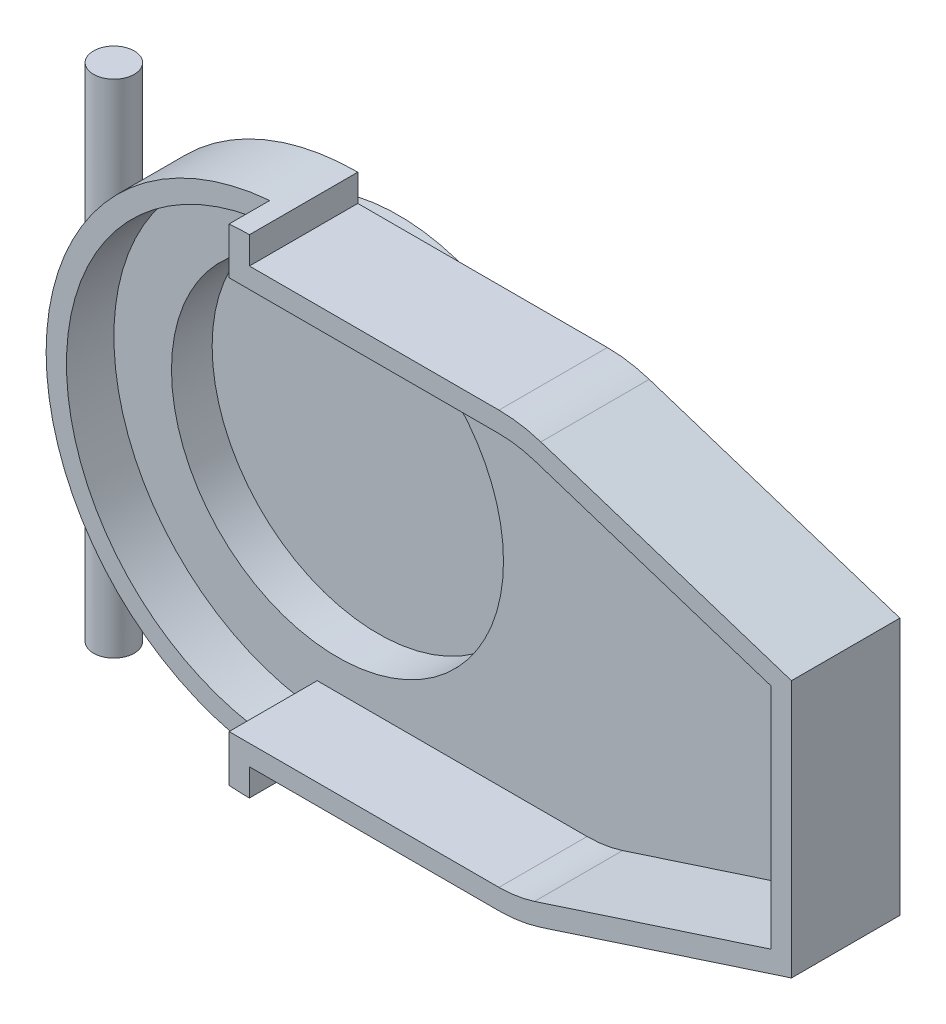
SolidWorks part; units mm, degrees
ref_plane "Plan de face" through (0, 0, 0) normal (0, 0, 1) x (1, 0, 0)
ref_plane "Plan de dessus" through (0, 0, 0) normal (0, 1, 0) x (1, 0, 0)
ref_plane "Plan de droite" through (0, 0, 0) normal (1, 0, 0) x (0, 0, -1)
sketch "Esquisse1" plane through (0, 0, 0) normal (0, 0, 1) x (1, 0, 0)
  circle A0 centre (0, 0) radius 13.75
  dimension "D1" = 27.5
extrude "Extrusion1" add sketch "Esquisse1" along normal blind 3
sketch "Esquisse3" plane through (137.6924, 0, 3) normal (0, 0, 1) x (1, 0, 0)
  line L0 (-79.3204, 0) -> (-194.2329, 0) construction
  line L1 (-137.6924, -16) -> (-119.2767, -16)
  line L2 (-116.1858, -15.5103) -> (-97.6924, -9.5)
  line L3 (-97.6924, -9.5) -> (-97.6924, 9.5)
  line L4 (-137.6924, -22.8025) -> (-137.6924, 21.1457) construction
  line L5 (-116.1858, 15.5103) -> (-97.6924, 9.5)
  line L6 (-137.6924, 16) -> (-119.2767, 16)
  line L7 (-137.6924, 16) -> (-137.6924, 18)
  line L8 (-137.6924, -16) -> (-137.6924, -18)
  arc A0 (-137.6924, 18) -> (-137.6924, -18) centre (-137.6924, 0) ccw
  arc A5 (-116.1858, -15.5103) -> (-119.2767, -16) centre (-119.2767, -6) cw
  arc A6 (-116.1858, 15.5103) -> (-119.2767, 16) centre (-119.2767, 6) ccw
  point P16 (-117.6924, -16)
  point P23 (-97.6924, 0)
  dimension "D5" = 10
  dimension "D2" = 40
  dimension "D6" = 36
  dimension "D1" = 16
  dimension "D3" = 9.5
  dimension "D4" = 20
extrude "Extrusion2" add sketch "Esquisse3" along normal blind 8
shell "Coque1" thickness 1.5
sketch "Esquisse4" plane through (0, 0, 0) normal (0, 1, 0) x (1, 0, 0)
  line L1 (-1.5, -8) -> (-23.946, -8)
  line L2 (-1.5, -8) -> (-1.5, -15.9502)
  line L3 (-1.5, -15.9502) -> (-23.946, -15.9502)
  line L4 (-23.946, -8) -> (-23.946, -15.9502)
  line L5 (0, -3) -> (-18, -3) construction
  line L7 (0, -11) -> (0, -3) construction
  dimension "D1" = 5
  dimension "D2" = 1.5
extrude "Enlèv. mat.-Extru.1" cut sketch "Esquisse4" against normal through all and the other way through all
ref_plane "Plan1" through (0, 18.5, 0) normal (0, 1, 0) x (-1, 0, 0)
sketch "Esquisse5" plane through (0, 18.5, 0) normal (0, 1, 0) x (-1, 0, 0)
  line L0 (18, 3) -> (18, 8) construction
  line L1 (0, 3) -> (18, 3) construction
  circle A0 centre (15.5, 5.5) radius 1.5
  dimension "D1" = 3
  dimension "D2" = 2.5
  dimension "D3" = 2.5
extrude "Extrusion3" add sketch "Esquisse5" against normal up to surface (9.3485 mm away)
mirror "Symétrie1" about plane through (0, 0, 0) normal (0, 1, 0) of "Extrusion3"
